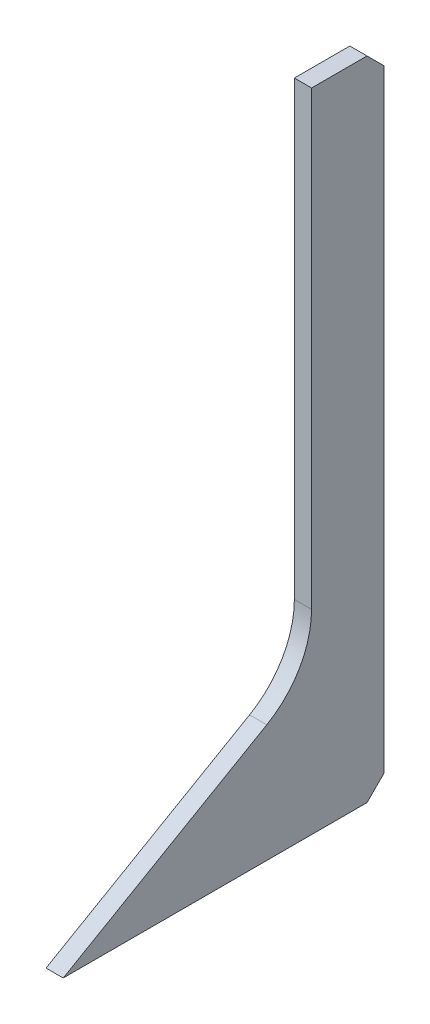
SolidWorks part; units mm, degrees
ref_plane "Front Plane" through (0, 0, 0) normal (0, 0, 1) x (1, 0, 0)
ref_plane "Top Plane" through (0, 0, 0) normal (0, 1, 0) x (1, 0, 0)
ref_plane "Right Plane" through (0, 0, 0) normal (1, 0, 0) x (0, 0, -1)
body saved out of another part "Stock-Piranha-h0400-4301-1"
sketch "Sketch1" plane through (387.6303, 0, 0) normal (1, 0, 0) x (0, 0, -1)
  line L0 (253.535, 155.0367) -> (256.535, 152.0367)
  line L1 (255.535, 155.0367) -> (243.708, 155.0367) construction
  line L2 (256.535, 41.4827) -> (256.535, 154.0367) construction
  line L3 (256.535, 152.0367) -> (256.535, 154.0367)
  line L4 (255.535, 155.0367) -> (253.535, 155.0367)
  line L5 (199.7139, 40.4827) -> (255.535, 40.4827) construction
  line L6 (256.535, 41.4827) -> (256.535, 43.4827)
  line L7 (253.535, 40.4827) -> (255.535, 40.4827)
  line L8 (256.535, 43.4827) -> (253.535, 40.4827)
  arc A0 (256.535, 154.0367) -> (255.535, 155.0367) centre (255.535, 154.0367) ccw construction
  arc A1 (256.535, 154.0367) -> (255.535, 155.0367) centre (255.535, 154.0367) ccw
  arc A2 (255.535, 40.4827) -> (256.535, 41.4827) centre (255.535, 41.4827) ccw construction
  arc A3 (255.535, 40.4827) -> (256.535, 41.4827) centre (255.535, 41.4827) ccw
  point P2 (256.535, 155.0367)
  point P10 (256.535, 40.4827)
  dimension "D1" = 3
  dimension "D2" = 3
  dimension "D3" = 3
  dimension "D4" = 3
extrude "Cut-Extrude1" cut sketch "Sketch1" against normal through all
